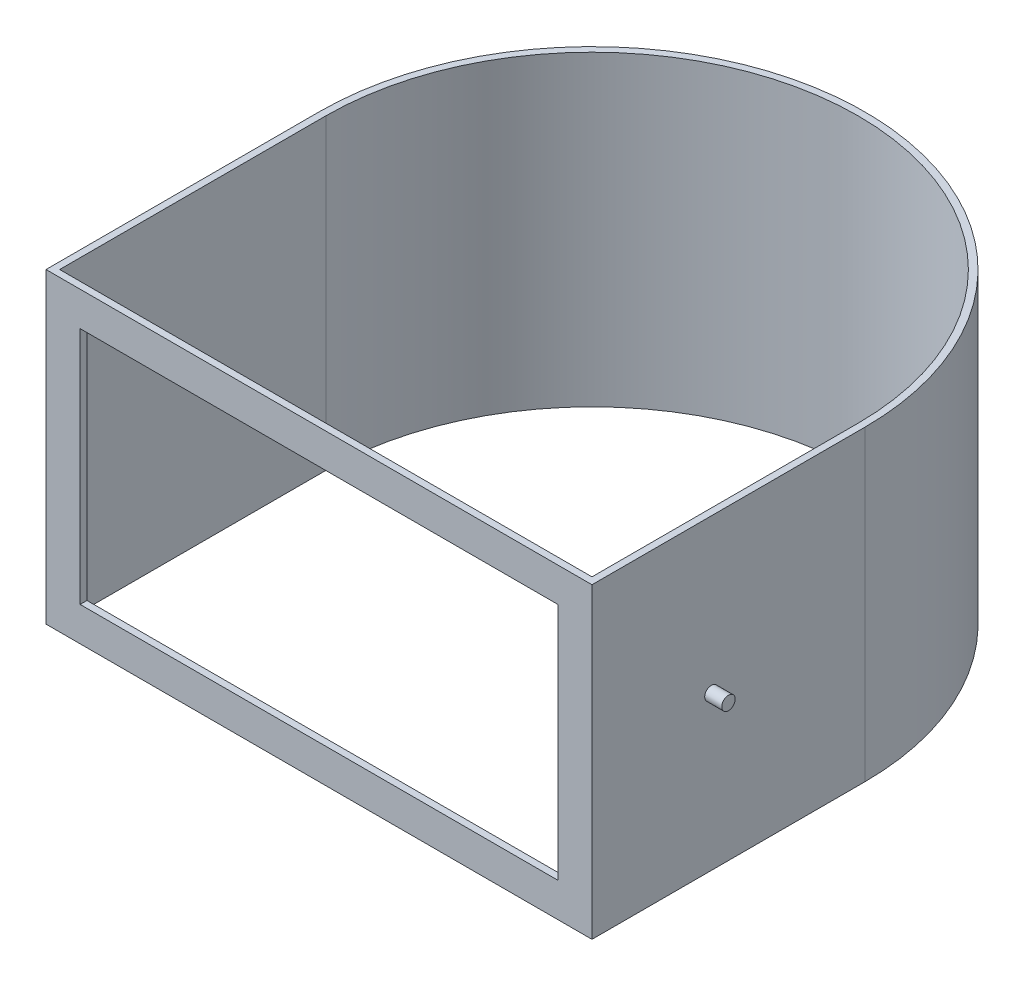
SolidWorks part; units mm, degrees
ref_plane "Front Plane" through (0, 0, 0) normal (0, 0, 1) x (1, 0, 0)
ref_plane "Top Plane" through (0, 0, 0) normal (0, 1, 0) x (1, 0, 0)
ref_plane "Right Plane" through (0, 0, 0) normal (1, 0, 0) x (0, 0, -1)
sketch "Sketch1" plane through (0, 0, 0) normal (0, 1, 0) x (1, 0, 0)
  line L1 (-101.6, 0) -> (101.6, 0)
  line L2 (-101.6, 0) -> (-101.6, -101.6)
  line L3 (-101.6, -101.6) -> (101.6, -101.6)
  line L4 (101.6, 0) -> (101.6, -101.6)
  circle A0 centre (0, 0) radius 101.6
  dimension "D1" = 203.2
extrude "Boss-Extrude1" add sketch "Sketch1" along normal blind 114.3 contours A0 L1 | A0 L2 L3 | L1 A0 | A0 L3 L4
shell "Shell1" thickness 2.54
sketch "Sketch7" plane through (-99.06, 0, 0) normal (1, 0, 0) x (0, 0, -1)
  line L0 (-57.15, 114.3) -> (-57.15, 0) construction
  line L1 (0, 114.3) -> (-101.6, 114.3) construction
  line L7 (0, 0) -> (-101.6, 0) construction
  line L8 (-101.6, 114.3) -> (-101.6, 0) construction
  circle A2 centre (-57.15, 57.15) radius 2.5
  dimension "D2" = 5
  dimension "D1" = 44.45
sketch "Sketch8" plane through (0, 0, 99.06) normal (0, 0, -1) x (-1, 0, 0)
  line L0 (0, 0) -> (0, 114.3) construction
  line L1 (101.6, 114.3) -> (-101.6, 114.3) construction
  circle A2 centre (0, 57.15) radius 2.5
  dimension "D1" = 5
extrude "Boss-Extrude2" add sketch "Sketch7" along normal blind 207.01 and the other way blind 8.89
extrude "Boss-Extrude3" add sketch "Sketch8" along normal blind 207.01
sketch "Sketch10" plane through (0, 2.54, 0) normal (0, 1, 0) x (1, 0, 0)
  line L1 (-99.06, -99.06) -> (99.06, -99.06)
  line L2 (-99.06, -99.06) -> (-99.06, 0)
  line L3 (-99.06, 0) -> (99.06, 0)
  line L4 (99.06, -99.06) -> (99.06, 0)
  circle A0 centre (0, 0) radius 99.06
  arc A1 (99.06, 0) -> (-99.06, 0) centre (0, 0) ccw construction
extrude "Cut-Extrude1" cut sketch "Sketch10" against normal through all both and the other way through all contours A0 | L2 L1 L4 L3
sketch "Sketch11" plane through (0, 0, 101.6) normal (0, 0, 1) x (1, 0, 0)
  line L0 (0, 0) -> (0, 114.3) construction
  line L1 (-101.6, 114.3) -> (101.6, 114.3) construction
  line L3 (-88.9, 12.7) -> (88.9, 12.7)
  line L4 (-88.9, 12.7) -> (-88.9, 101.6)
  line L5 (-88.9, 101.6) -> (88.9, 101.6)
  line L6 (88.9, 12.7) -> (88.9, 101.6)
  line L7 (-88.9, 12.7) -> (88.9, 101.6) construction
  line L8 (-88.9, 101.6) -> (88.9, 12.7) construction
  point P5 (0, 57.15)
  dimension "D1" = 88.9
  dimension "D2" = 177.8
extrude "Cut-Extrude2" cut sketch "Sketch11" against normal blind 2.54
